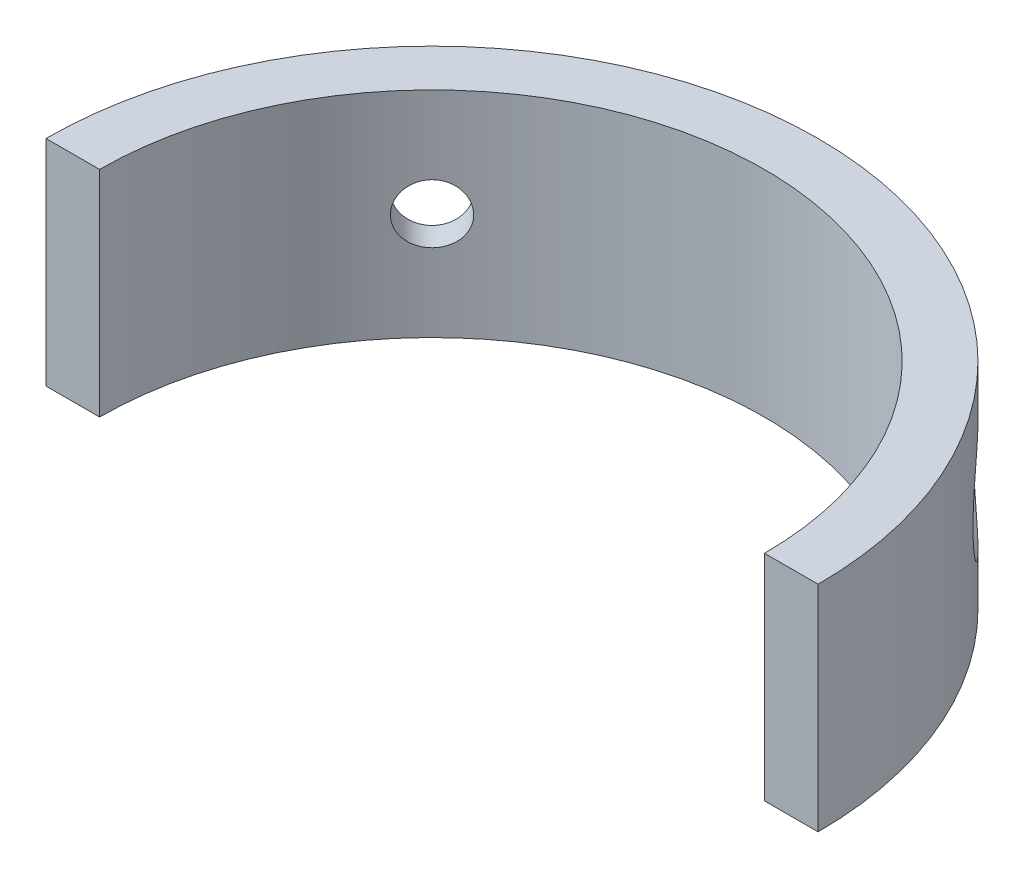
SolidWorks part; units mm, degrees
ref_plane "Plan de face" through (0, 0, 0) normal (0, 0, 1) x (1, 0, 0)
ref_plane "Plan de dessus" through (0, 0, 0) normal (0, 1, 0) x (1, 0, 0)
ref_plane "Plan de droite" through (0, 0, 0) normal (1, 0, 0) x (0, 0, -1)
sketch "Esquisse1" plane through (0, 0, 0) normal (0, 1, 0) x (1, 0, 0)
  line L0 (-31, 0) -> (31, 0) construction
  line L1 (-36, 0) -> (-31, 0)
  line L2 (31, 0) -> (36, 0)
  arc A0 (31, 0) -> (-31, 0) centre (0, 0) ccw
  arc A1 (36, 0) -> (-36, 0) centre (0, 0) ccw
  dimension "D1" = 72
  dimension "D2" = 62
extrude "Boss.-Extru.1" add sketch "Esquisse1" along normal blind 20
sketch "Esquisse2" plane through (0, 0, 0) normal (0, 1, 0) x (1, 0, 0)
  line L0 (0, 0) -> (-36.7962, 36.7962) construction
  line L1 (-36, 0) -> (-31, 0) construction
  dimension "D1" = 45
ref_plane "Plan1" through (-25.4558, 0, -25.4558) normal (-0.7071, 0, -0.7071) x (-0.7071, 0, 0.7071)
sketch "Esquisse3" plane through (-25.4558, 0, -25.4558) normal (-0.7071, 0, -0.7071) x (-0.7071, 0, 0.7071)
  line L0 (0, 0) -> (0, 20) construction
  line L1 (25.4558, 20) -> (-36, 20) construction
  point P6 (0, 10)
hole_wizard "Fraisage pour vis à tête fraisée M51" positions "Esquisse3D5" profile "Esquisse8" countersink size "M5" standard "ISO"
sketch3d "Esquisse3D5"
  line L0 (-25.4558, 0, -25.4558) -> (-25.4558, 20, -25.4558) construction
  point P0 (-25.4558, 10, -25.4558)
  point P4 (-25.4558, 9.0387, -25.4558)
  point P8 (-25.4558, 10, -25.4558)
sketch "Esquisse8" plane through (-25.4558, 10, -25.4558) normal (0, 1, 0) x (-0.7071, 0, 0.7071)
  line L0 (0, 0) -> (0, 61.4558)
  line L1 (0, 61.4558) -> (2.75, 61.4558)
  line L2 (2.75, 61.4558) -> (2.75, 2.45)
  line L3 (2.75, 2.45) -> (5.2, 0)
  line L5 (5.2, 0) -> (0, 0)
  line L6 (-2.75, 2.45) -> (-5.2, 0) construction
  line L11 (0, -6.35) -> (0, 107.95) construction
  dimension "Diamètre du perçage jusqu'au prochain" = 5.5
  dimension "Profondeur du perçage jusqu'au prochain" = 61.4558
  dimension "Diamètre du fraisage entrant" = 10.4
  dimension "Angle du fraisage entrant" = 90
pattern_circular "Répétition circulaire1" count 2 over 90 about axis through (0, 20, 0) along (0, -1, 0) of "Fraisage pour vis à tête fraisée M51"
